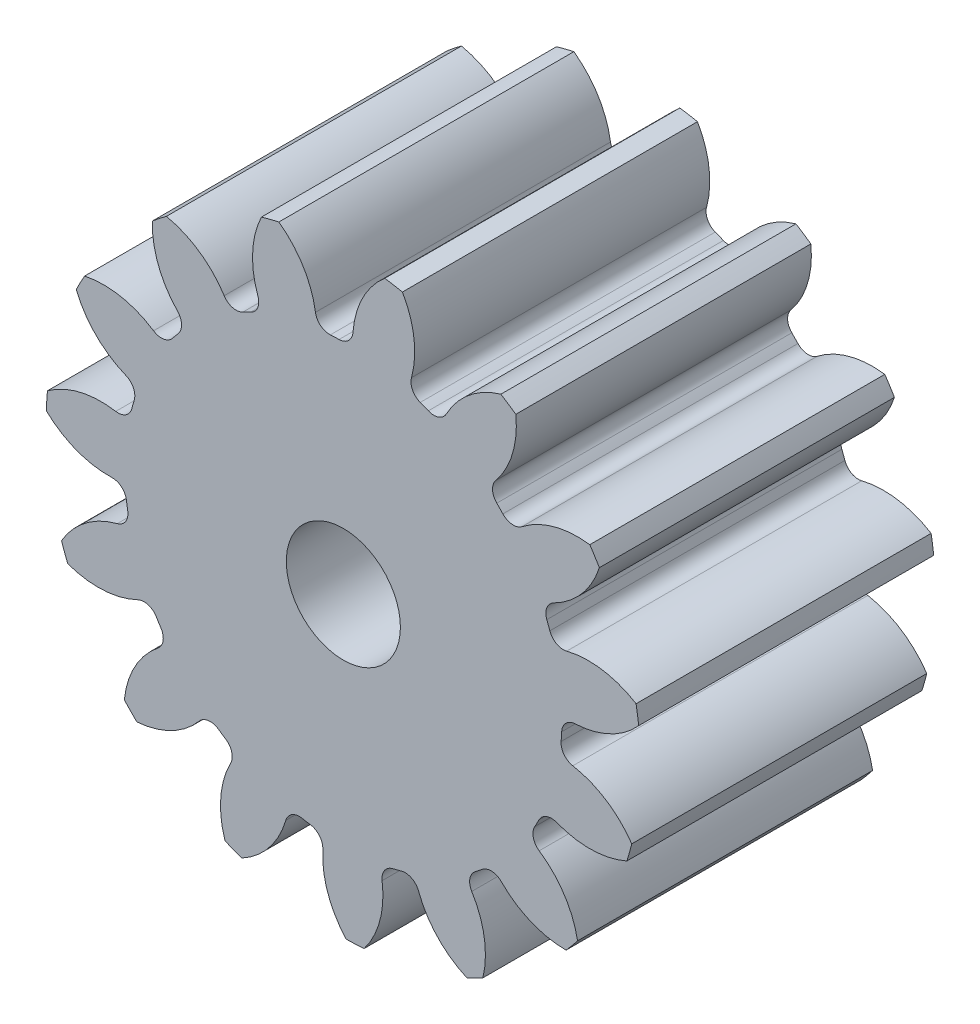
SolidWorks part; units mm, degrees
ref_plane "Front" through (0, 0, 0) normal (0, 0, 1) x (1, 0, 0)
ref_plane "Top" through (0, 0, 0) normal (0, 1, 0) x (1, 0, 0)
ref_plane "Right" through (0, 0, 0) normal (1, 0, 0) x (0, 0, -1)
sketch "Sketch3" plane through (0, 0, 0) normal (0, 0, 1) x (1, 0, 0)
  circle A0 centre (0, 0) radius 95.9556
  dimension "od" = 191.9111
extrude "gearBody" add sketch "Sketch3" along normal blind 95.25
sketch "Sketch2" plane through (0, 0, 0) normal (0, 0, 1) x (1, 0, 0)
  line L0 (0, 0) -> (73.5044, 30.4465) construction
  line L1 (93.6275, -24.0189) -> (0, 0) construction
  line L2 (0, 0) -> (36.3143, 0) construction
  line L3 (84.6006, 3.3447) -> (83.4477, -14.315) construction
  line L5 (84.0242, -5.4852) -> (0, 0) construction
  line L7 (0, 0) -> (79.5606, 0) construction
  arc A0 (79.5405, 1.7899) -> (78.6327, -12.1156) centre (0, 0) ccw construction
  arc A1 (95.3319, 10.9223) -> (93.1028, -23.2235) centre (0, 0) ccw construction
  arc A2 (84.6006, 3.3447) -> (83.4477, -14.315) centre (0, 0) ccw construction
  arc A3 (70.2999, -6.0011) -> (70.4834, -3.1894) centre (0, 0) ccw
  arc A4 (93.6275, -24.0189) -> (74.0702, -10.9149) centre (68.9223, -39.7443) ccw
  arc A5 (93.6275, -24.0189) -> (95.9556, 11.6428) centre (0, 0) ccw
  arc A6 (95.9556, 11.6428) -> (74.8606, 1.1926) centre (73.5044, 30.4465) cw
  arc A7 (70.4834, -3.1894) -> (74.8606, 1.1926) centre (75.0733, -3.3971) cw
  arc A8 (74.0702, -10.9149) -> (70.2999, -6.0011) centre (74.8778, -6.3918) cw
  point P6 (95.9556, 11.6428)
  point P22 (93.6275, -24.0189)
  dimension "baseDia" = 159.1213
  dimension "od" = 191.9111
  dimension "pd" = 169.3333
  dimension "rd" = 141.1111
  dimension "rFillet" = 4.5946
  dimension "pointX" = 95.9556
  dimension "pointY" = 11.6428
  dimension "CTT" = 17.6597
  dimension "flankCenterAngle" = 22.5
extrude "toothCut" cut sketch "Sketch2" along normal through all
pattern_circular "CirPattern1" count 15 over 360 about axis through (0, 0, 0) along (0, 0, 1) of "toothCut"
sketch "hub1Dia" plane through (0, 0, 0) normal (0, 0, -1) x (-1, 0, 0)
  circle A0 centre (0, 0) radius 12.7
  dimension "hub1Dia" = 25.4
sketch "hub2Dia" plane through (0, 0, 95.25) normal (0, 0, 1) x (1, 0, 0)
  circle A0 centre (0, 0) radius 12.7
  dimension "hub2dia" = 25.4
sketch "boreDia" plane through (0, 0, 0) normal (0, 0, 1) x (1, 0, 0)
  circle A0 centre (0, 0) radius 18.415
  dimension "boreDia" = 36.83
extrude "bore" cut sketch "boreDia" against normal mid plane 25400
